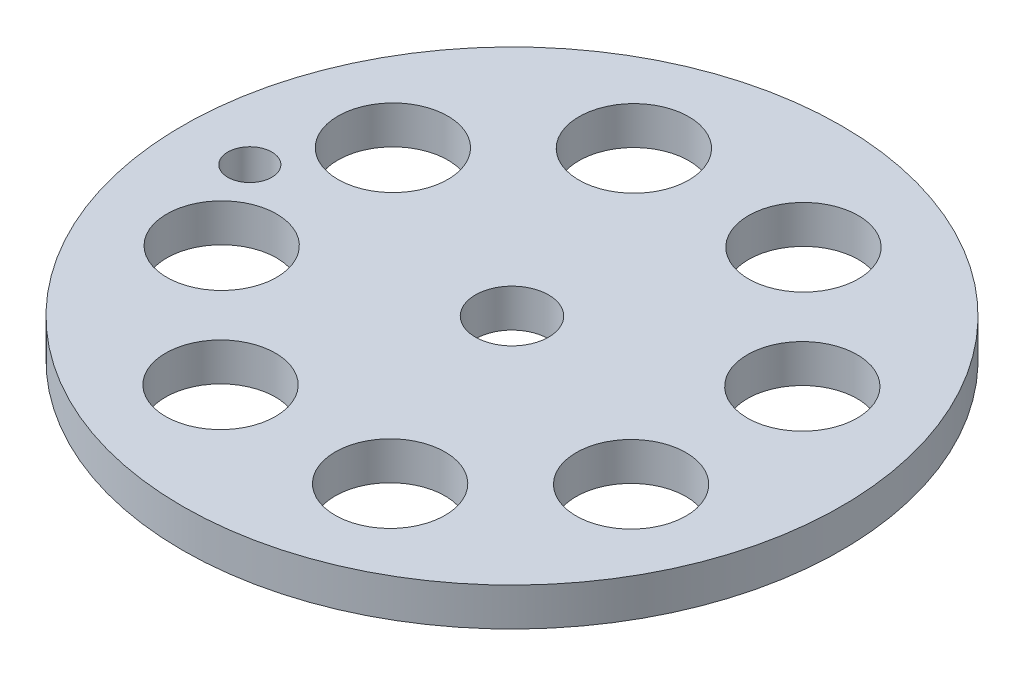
SolidWorks part; units mm, degrees
ref_plane "Front" through (0, 0, 0) normal (0, 0, 1) x (1, 0, 0)
ref_plane "Top" through (0, 0, 0) normal (0, 1, 0) x (1, 0, 0)
ref_plane "Right" through (0, 0, 0) normal (1, 0, 0) x (0, 0, -1)
sketch "Sketch1" plane through (0, 0, 0) normal (0, 1, 0) x (1, 0, 0)
  circle A0 centre (0, 0) radius 28.575
  circle A1 centre (0, 0) radius 3.175
  dimension "D1" = 57.15
  dimension "D2" = 6.35
extrude "Extrude1" add sketch "Sketch1" along normal mid plane 3.302
sketch "Sketch2" plane through (0, 1.651, 0) normal (0, 1, 0) x (-1, 0, 0)
  line L0 (0, 0) -> (-28.575, 0) construction
  circle A0 centre (0, 0) radius 19.304 construction
  circle A1 centre (0, 0) radius 28.575 construction
  circle A2 centre (-17.8695, -7.3025) radius 4.7625
  dimension "D1" = 38.608
  dimension "D2" = 9.525
  dimension "D3" = 7.3025
extrude "Cut-Extrude1" cut sketch "Sketch2" against normal through all
pattern_circular "CirPattern1" count 8 over 360 about axis through (0, 0, 0) along (0, 1, 0) of "Cut-Extrude1"
sketch "Sketch3" plane through (0, 1.651, 0) normal (0, 1, 0) x (-1, 0, 0)
  line L0 (1.8161, 0) -> (-1.8161, 0) construction
  line L1 (0, 0) -> (0, -10.0613) construction
  arc A0 (22.4156, 3.7856) -> (22.3653, -4.072) centre (0, 0) cw construction
  circle A1 centre (22.733, 0) radius 1.905
  dimension "D1" = 22.733
  dimension "D2" = 3.81
extrude "Cut-Extrude2" cut sketch "Sketch3" against normal through all
